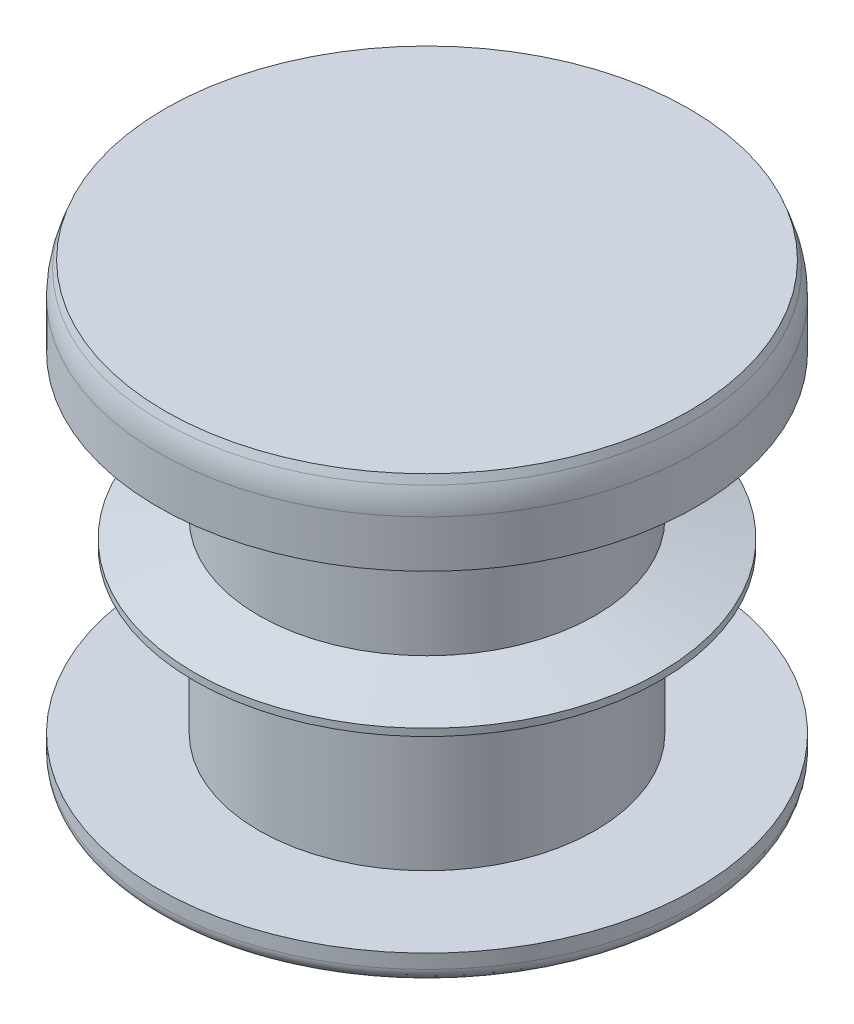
SolidWorks part; units mm, degrees
ref_plane "X_Y" through (0, 0, 0) normal (0, 0, 1) x (1, 0, 0)
ref_plane "Z_X" through (0, 0, 0) normal (0, 1, 0) x (1, 0, 0)
ref_plane "Y_Z" through (0, 0, 0) normal (1, 0, 0) x (0, 0, -1)
sketch "Sketch1" plane through (0, 0, 0) normal (0, 0, 1) x (1, 0, 0)
  line L0 (0, 0) -> (0, -7.9996)
  line L2 (0.5, -7.9996) -> (3.76, -6.0408)
  line L3 (3.76, -6.0408) -> (3.76, -5.73)
  line L4 (3.76, -5.73) -> (2.35, -5.73)
  line L5 (2.35, -5.73) -> (2.35, -3.7112)
  line L6 (2.35, -3.7112) -> (3.25, -3.47)
  line L7 (3.25, -3.47) -> (3.25, -3.37)
  line L8 (3.66, 0) -> (0, 0)
  line L9 (0.5, -7.9996) -> (0, -7.9996)
  line L10 (3.66, 0) -> (3.76, -0.2747)
  line L11 (0, -0.5526) -> (0, -50000.5526) construction
  line L12 (3.25, -3.37) -> (2.35, -3.1288)
  line L13 (2.35, -3.1288) -> (2.35, -1.11)
  line L14 (2.35, -1.11) -> (3.76, -1.11)
  line L15 (3.76, -1.11) -> (3.76, -0.2747)
  circle A0 centre (3.239, -4.3933) radius 0.889 construction
  point P10 (0, -8.3)
  dimension "D15" = 1.778
  dimension "D1" = 6.0408
  dimension "D2" = 7.52
  dimension "D3" = 59
  dimension "D4" = 0.3108
  dimension "D5" = 4.62
  dimension "D6" = 4.7
  dimension "D7" = 0.5
  dimension "D8" = 0.1
  dimension "D9" = 20
  dimension "D10" = 8.3
  dimension "D11" = 5.73
  dimension "D12" = 75
  dimension "D13" = 1.11
  dimension "D14" = 75
  dimension "D16" = 6.5
  dimension "D17" = 0.1
revolve "Revolve1" add sketch "Sketch1" angle 360 about L0
fillet "Fillet1" radius 0.2 1 edges at (-3.76, -6.0408, 0)
fillet "Fillet2" radius 1 1 edges at (-3.76, -0.2747, 0)
